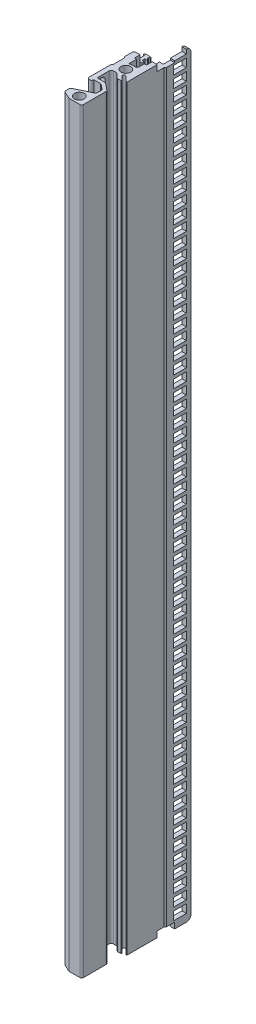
SolidWorks part; units mm, degrees
ref_plane "前视基准面" through (0, 0, 0) normal (0, 0, 1) x (1, 0, 0)
ref_plane "上视基准面" through (0, 0, 0) normal (0, 1, 0) x (1, 0, 0)
ref_plane "右视基准面" through (0, 0, 0) normal (1, 0, 0) x (0, 0, -1)
sketch "草图1" plane through (0, 0, 0) normal (0, 1, 0) x (1, 0, 0)
  line L0 (-4.2, 11.9) -> (-3.9, 11.9)
  line L1 (-4.4, 12.2) -> (-4.4, 12.1)
  line L2 (-4.0328, 12.4) -> (-4.2, 12.4)
  line L3 (-3.85, 12.5) -> (-3.8914, 12.4586)
  line L4 (-2.05, 12.5) -> (-3.85, 12.5)
  line L5 (-2.0086, 12.4586) -> (-2.05, 12.5)
  line L6 (-1.7, 12.4) -> (-1.8672, 12.4)
  line L7 (-1.5, 12.1) -> (-1.5, 12.2)
  line L8 (-1.8, 11.9) -> (-1.7, 11.9)
  line L9 (-2, 11.4828) -> (-2, 11.7)
  line L10 (-1.3586, 10.7586) -> (-1.9414, 11.3414)
  line L11 (-1.3, 10.55) -> (-1.3, 10.6172)
  line L12 (-3.7, 11.7) -> (-3.7, 9.95)
  line L13 (-5, -10.75) -> (-5, -1.6)
  line L14 (-3, -9.35) -> (-3, -5.75)
  line L16 (1.6887, -3.3855) -> (3.2118, -4.9086)
  line L17 (2.5373, -2.537) -> (4.6586, -4.6583)
  line L18 (5, 15) -> (5, 5.1793)
  line L19 (3.6, 15) -> (5, 15)
  line L20 (3.6, 12.5) -> (3.6, 15)
  line L21 (1.95, 12.5) -> (3.6, 12.5)
  line L22 (1.95, 10.55) -> (1.95, 12.5)
  line L23 (2.85, 10.55) -> (1.95, 10.55)
  line L24 (2.85, 9.35) -> (2.85, 10.55)
  line L25 (1.95, 9.35) -> (2.85, 9.35)
  line L26 (1.95, 8.35) -> (1.95, 9.35)
  line L27 (2.85, 8.35) -> (1.95, 8.35)
  line L28 (2.85, 6.05) -> (2.85, 8.35)
  line L29 (1.95, 6.05) -> (2.85, 6.05)
  line L30 (1.95, 3.8856) -> (1.95, 6.05)
  line L31 (-1.45, 6.05) -> (-1.45, 2.9458)
  line L32 (-2.35, 6.05) -> (-1.45, 6.05)
  line L33 (-2.35, 8.35) -> (-2.35, 6.05)
  line L34 (-1.45, 8.35) -> (-2.35, 8.35)
  line L35 (-1.45, 9.35) -> (-1.45, 8.35)
  line L36 (-2.35, 9.35) -> (-1.45, 9.35)
  line L37 (-2.35, 10.55) -> (-2.35, 9.35)
  line L38 (-1.3, 10.55) -> (-2.35, 10.55)
  line L39 (-4.45, 7.7) -> (-4.7, 7.7)
  line L40 (-5, 7.4) -> (-4.7, 7.7)
  line L41 (-5, 4.4) -> (-5, 7.4)
  line L42 (-4.5499, 3.8998) -> (-5, 4.4)
  line L43 (-4.45, 7.7) -> (-4.45, 9.55)
  line L44 (-3.9, 9.75) -> (-4.25, 9.75)
  line L45 (-4.5499, 3.8998) -> (-4.5501, -1.1002)
  line L46 (-5, -1.6) -> (-4.5501, -1.1002)
  line L47 (4.9414, -1.9395) -> (4.6464, -1.6446) construction
  line L48 (5, -2.081) -> (5, -4.5169)
  line L49 (0, 0) -> (0, -5) construction
  line L50 (4.5, -1.291) -> (4.5, 4.3894) construction
  line L53 (-2.5, -5.25) -> (3.0703, -5.25)
  line L54 (2.5373, -2.537) -> (1.6887, -3.3855) construction
  line L55 (5, 5.1793) -> (5, -2.081)
  line L58 (4.9414, 5.0379) -> (4.6464, 4.743) construction
  line L121 (-3, -9.35) -> (4, -9.35)
  line L122 (-4.2, -17.25) -> (2.6, -17.25)
  line L123 (-5, -22.2) -> (-5, -18.05)
  line L124 (-3, -10.75) -> (2.6, -10.75)
  line L125 (4, -9.35) -> (4, -22.2)
  line L126 (3.2, -23) -> (-4.2, -23)
  line L127 (2.6, -10.75) -> (2.6, -17.25)
  circle A0 centre (0, 0) radius 1.6
  arc A1 (-4.4, 12.1) -> (-4.2, 11.9) centre (-4.2, 12.1) ccw
  arc A2 (-4.2, 12.4) -> (-4.4, 12.2) centre (-4.2, 12.2) ccw
  arc A3 (-4.0328, 12.4) -> (-3.8914, 12.4586) centre (-4.0328, 12.6) ccw
  arc A4 (-2.0086, 12.4586) -> (-1.8672, 12.4) centre (-1.8672, 12.6) ccw
  arc A5 (-1.5, 12.2) -> (-1.7, 12.4) centre (-1.7, 12.2) ccw
  arc A6 (-1.7, 11.9) -> (-1.5, 12.1) centre (-1.7, 12.1) ccw
  arc A7 (-1.8, 11.9) -> (-2, 11.7) centre (-1.8, 11.7) ccw
  arc A8 (-2, 11.4828) -> (-1.9414, 11.3414) centre (-1.8, 11.4828) ccw
  arc A9 (-1.3, 10.6172) -> (-1.3586, 10.7586) centre (-1.5, 10.6172) ccw
  arc A11 (3.0703, -5.25) -> (3.2118, -4.9086) centre (3.0703, -5.05) ccw
  arc A12 (-4.25, 9.75) -> (-4.45, 9.55) centre (-4.25, 9.55) ccw
  arc A13 (-3.9, 9.75) -> (-3.7, 9.95) centre (-3.9, 9.95) ccw
  arc A14 (5, -2.081) -> (4.9414, -1.9395) centre (4.8, -2.081) ccw construction
  arc A15 (4.9414, 5.0379) -> (5, 5.1793) centre (4.8, 5.1793) ccw construction
  arc A16 (4.6586, -4.6583) -> (5, -4.5169) centre (4.8, -4.5169) ccw
  arc A17 (2.5373, -2.537) -> (1.6887, -3.3855) centre (2.113, -2.9613) ccw
  arc A18 (0.7125, 2.9142) -> (-1.1719, 2.7616) centre (0, 0) ccw
  arc A19 (-1.45, 2.9458) -> (-1.1719, 2.7616) centre (-1.25, 2.9458) ccw
  arc A20 (0.7125, 2.9142) -> (1.95, 3.8856) centre (0.95, 3.8856) ccw
  arc A21 (-3.7, 11.7) -> (-3.9, 11.9) centre (-3.9, 11.7) ccw
  arc A22 (4.6464, -1.6446) -> (4.5, -1.291) centre (5, -1.291) cw construction
  arc A23 (4.5, 4.3894) -> (4.6464, 4.743) centre (5, 4.3894) cw construction
  arc A29 (-3, -5.75) -> (-2.5, -5.25) centre (-2.5, -5.75) cw
  arc A60 (-5, -22.2) -> (-4.2, -23) centre (-4.2, -22.2) ccw
  circle A61 centre (0, -20) radius 1.6
  arc A62 (-4.2, -17.25) -> (-5, -18.05) centre (-4.2, -18.05) ccw
  arc A63 (-5, -10.75) -> (-3, -10.75) centre (-4, -10.75) ccw
  arc A64 (3.2, -23) -> (4, -22.2) centre (3.2, -22.2) ccw
  dimension "D1" = 3.2
  dimension "D3" = 5.2
  dimension "D4" = 45
  dimension "D5" = 1.2
  dimension "D7" = 0.6
  dimension "D8" = 0.2
  dimension "D10" = 4.1
  dimension "D11" = 1.4
  dimension "D12" = 0.5
  dimension "D13" = 0.5
  dimension "D14" = 1
  dimension "D33" = 3.2
  dimension "D34" = 20
  dimension "D37" = 0.8
  dimension "D38" = 0.8
  dimension "D39" = 0.8
  dimension "D6" = 3
  dimension "D9" = 2.1225
  dimension "D28" = 38
  dimension "D29" = 13.65
  dimension "D30" = 1
  dimension "D31" = 9
  dimension "D32" = 5.75
  dimension "D36" = 6.5
extrude "凸台-拉伸1" add sketch "草图1" along normal mid plane 325.12
sketch "草图6" plane through (0, 162.56, 0) normal (0, 1, 0) x (1, 0, 0)
  line L0 (3.6, 12.5) -> (3.6, 22.5)
  line L1 (3.6, 22.5) -> (5.5, 22.5)
  line L2 (5.5, 22.5) -> (5.5, 12)
  line L3 (5.5, 12) -> (5, 11.5)
  line L4 (3.6, 12.5) -> (5, 11.5)
  line L5 (5, -4.5169) -> (5, 15) construction
  line L6 (-5, 7.4) -> (-5, 4.4) construction
  dimension "D4" = 11
  dimension "D1" = 10.5
  dimension "D2" = 10
  dimension "D3" = 45
extrude "凸台-拉伸2" add sketch "草图6" against normal up to surface (325.12 mm away)
sketch "草图2" plane through (0, 162.56, 0) normal (0, 1, 0) x (1, 0, 0)
  circle A0 centre (0, 0) radius 2.1
  circle A1 centre (0, -20) radius 2.1
  dimension "D1" = 4.2
  dimension "D2" = 4.2
extrude "切除-拉伸1" cut sketch "草图2" against normal blind 10
sketch "草图3" plane through (0, -162.56, 0) normal (0, -1, 0) x (1, 0, 0)
  circle A0 centre (0, 0) radius 2.1
  circle A1 centre (0, 20) radius 2.1
  dimension "D1" = 4.2
  dimension "D2" = 4.2
extrude "切除-拉伸2" cut sketch "草图3" against normal blind 10
sketch "草图4" plane through (-5, 0, 0) normal (-1, 0, 0) x (0, 0, 1)
  line L0 (1.6, -162.56) -> (10.75, -162.56) construction
  line L2 (11.75, -162.56) -> (11.75, 162.56) construction
  circle A0 centre (7.5, -160.02) radius 1.65
  circle A1 centre (7.5, -154.94) radius 1.65
  circle A2 centre (7.5, -149.86) radius 1.65
  circle A3 centre (7.5, -144.78) radius 1.65
  circle A4 centre (7.5, -139.7) radius 1.65
  circle A5 centre (7.5, -134.62) radius 1.65
  circle A6 centre (7.5, -129.54) radius 1.65
  circle A7 centre (7.5, -124.46) radius 1.65
  circle A8 centre (7.5, -119.38) radius 1.65
  circle A9 centre (7.5, -114.3) radius 1.65
  circle A10 centre (7.5, -109.22) radius 1.65
  circle A11 centre (7.5, -104.14) radius 1.65
  circle A12 centre (7.5, -99.06) radius 1.65
  circle A13 centre (7.5, -93.98) radius 1.65
  circle A14 centre (7.5, -88.9) radius 1.65
  circle A15 centre (7.5, -83.82) radius 1.65
  circle A16 centre (7.5, -78.74) radius 1.65
  circle A17 centre (7.5, -73.66) radius 1.65
  circle A18 centre (7.5, -68.58) radius 1.65
  circle A19 centre (7.5, -63.5) radius 1.65
  circle A20 centre (7.5, -58.42) radius 1.65
  circle A21 centre (7.5, -53.34) radius 1.65
  circle A22 centre (7.5, -48.26) radius 1.65
  circle A23 centre (7.5, -43.18) radius 1.65
  circle A24 centre (7.5, -38.1) radius 1.65
  circle A25 centre (7.5, -33.02) radius 1.65
  circle A26 centre (7.5, -27.94) radius 1.65
  circle A27 centre (7.5, -22.86) radius 1.65
  circle A28 centre (7.5, -17.78) radius 1.65
  circle A29 centre (7.5, -12.7) radius 1.65
  circle A30 centre (7.5, -7.62) radius 1.65
  circle A31 centre (7.5, -2.54) radius 1.65
  circle A32 centre (7.5, 2.54) radius 1.65
  circle A33 centre (7.5, 7.62) radius 1.65
  circle A34 centre (7.5, 12.7) radius 1.65
  circle A35 centre (7.5, 17.78) radius 1.65
  circle A36 centre (7.5, 22.86) radius 1.65
  circle A37 centre (7.5, 27.94) radius 1.65
  circle A38 centre (7.5, 33.02) radius 1.65
  circle A39 centre (7.5, 38.1) radius 1.65
  circle A40 centre (7.5, 43.18) radius 1.65
  circle A41 centre (7.5, 48.26) radius 1.65
  circle A42 centre (7.5, 53.34) radius 1.65
  circle A43 centre (7.5, 58.42) radius 1.65
  circle A44 centre (7.5, 63.5) radius 1.65
  circle A45 centre (7.5, 68.58) radius 1.65
  circle A46 centre (7.5, 73.66) radius 1.65
  circle A47 centre (7.5, 78.74) radius 1.65
  circle A48 centre (7.5, 83.82) radius 1.65
  circle A49 centre (7.5, 88.9) radius 1.65
  circle A50 centre (7.5, 93.98) radius 1.65
  circle A51 centre (7.5, 99.06) radius 1.65
  circle A52 centre (7.5, 104.14) radius 1.65
  circle A53 centre (7.5, 109.22) radius 1.65
  circle A54 centre (7.5, 114.3) radius 1.65
  circle A55 centre (7.5, 119.38) radius 1.65
  circle A56 centre (7.5, 124.46) radius 1.65
  circle A57 centre (7.5, 129.54) radius 1.65
  circle A58 centre (7.5, 134.62) radius 1.65
  circle A59 centre (7.5, 139.7) radius 1.65
  circle A60 centre (7.5, 144.78) radius 1.65
  circle A61 centre (7.5, 149.86) radius 1.65
  circle A62 centre (7.5, 154.94) radius 1.65
  circle A63 centre (7.5, 160.02) radius 1.65
  circle A64 centre (7.5, 165.1) radius 1.65
  circle A65 centre (7.5, 170.18) radius 1.65
  circle A66 centre (7.5, 175.26) radius 1.65
  circle A67 centre (7.5, 180.34) radius 1.65
  circle A68 centre (7.5, 185.42) radius 1.65
  circle A69 centre (7.5, 190.5) radius 1.65
  circle A70 centre (7.5, 195.58) radius 1.65
  circle A71 centre (7.5, 200.66) radius 1.65
  circle A72 centre (7.5, 205.74) radius 1.65
  circle A73 centre (7.5, 210.82) radius 1.65
  circle A74 centre (7.5, 215.9) radius 1.65
  circle A75 centre (7.5, 220.98) radius 1.65
  circle A76 centre (7.5, 226.06) radius 1.65
  circle A77 centre (7.5, 231.14) radius 1.65
  circle A78 centre (7.5, 236.22) radius 1.65
  circle A79 centre (7.5, 241.3) radius 1.65
  circle A80 centre (7.5, 246.38) radius 1.65
  circle A81 centre (7.5, 251.46) radius 1.65
  circle A82 centre (7.5, 256.54) radius 1.65
  circle A83 centre (7.5, 261.62) radius 1.65
  circle A84 centre (7.5, 266.7) radius 1.65
  dimension "D1" = 2.54
  dimension "D2" = 4.25
  dimension "D3" = 3.3
  dimension "D5" = 5.08
  dimension "D4" = 85
extrude "切除-拉伸3" cut sketch "草图4" against normal blind 12
sketch "草图5" plane through (5.5, 0, 0) normal (1, 0, 0) x (0, 0, -1)
  line L0 (-19.1753, 0) -> (41.1348, 0) construction
  line L1 (15.5, 162.56) -> (8.5, 162.56)
  line L2 (15.5, 162.56) -> (15.5, 160.02)
  line L3 (15.5, 160.02) -> (8.5, 160.02)
  line L4 (8.5, 162.56) -> (8.5, 160.02)
  line L6 (8.5, -162.56) -> (8.5, -160.02)
  line L7 (15.5, -160.02) -> (8.5, -160.02)
  line L8 (15.5, -162.56) -> (15.5, -160.02)
  line L9 (15.5, -162.56) -> (8.5, -162.56)
  line L10 (12, 162.56) -> (22.5, 162.56) construction
  line L11 (22.5, -162.56) -> (22.5, 162.56) construction
  dimension "D1" = 7
  dimension "D2" = 2.54
  dimension "D3" = 7
extrude "切除-拉伸4" cut sketch "草图5" against normal through all
sketch "草图7" plane through (5.5, 0, 0) normal (1, 0, 0) x (0, 0, -1)
  line L0 (22.5, -162.56) -> (22.5, 162.56) construction
  line L1 (15, -159.28) -> (20.5, -159.28)
  line L2 (15, -159.28) -> (15, -155.68)
  line L3 (15, -155.68) -> (20.5, -155.68)
  line L4 (20.5, -159.28) -> (20.5, -155.68)
  line L5 (22.5, -162.56) -> (15.5, -162.56) construction
  line L6 (15, -154.2) -> (20.5, -154.2)
  line L7 (15, -154.2) -> (15, -150.6)
  line L8 (15, -150.6) -> (20.5, -150.6)
  line L9 (20.5, -154.2) -> (20.5, -150.6)
  line L10 (15, -149.12) -> (20.5, -149.12)
  line L11 (15, -149.12) -> (15, -145.52)
  line L12 (15, -145.52) -> (20.5, -145.52)
  line L13 (20.5, -149.12) -> (20.5, -145.52)
  line L14 (15, -144.04) -> (20.5, -144.04)
  line L15 (15, -144.04) -> (15, -140.44)
  line L16 (15, -140.44) -> (20.5, -140.44)
  line L17 (20.5, -144.04) -> (20.5, -140.44)
  line L18 (15, -138.96) -> (20.5, -138.96)
  line L19 (15, -138.96) -> (15, -135.36)
  line L20 (15, -135.36) -> (20.5, -135.36)
  line L21 (20.5, -138.96) -> (20.5, -135.36)
  line L22 (15, -133.88) -> (20.5, -133.88)
  line L23 (15, -133.88) -> (15, -130.28)
  line L24 (15, -130.28) -> (20.5, -130.28)
  line L25 (20.5, -133.88) -> (20.5, -130.28)
  line L26 (15, -128.8) -> (20.5, -128.8)
  line L27 (15, -128.8) -> (15, -125.2)
  line L28 (15, -125.2) -> (20.5, -125.2)
  line L29 (20.5, -128.8) -> (20.5, -125.2)
  line L30 (15, -123.72) -> (20.5, -123.72)
  line L31 (15, -123.72) -> (15, -120.12)
  line L32 (15, -120.12) -> (20.5, -120.12)
  line L33 (20.5, -123.72) -> (20.5, -120.12)
  line L34 (15, -118.64) -> (20.5, -118.64)
  line L35 (15, -118.64) -> (15, -115.04)
  line L36 (15, -115.04) -> (20.5, -115.04)
  line L37 (20.5, -118.64) -> (20.5, -115.04)
  line L38 (15, -113.56) -> (20.5, -113.56)
  line L39 (15, -113.56) -> (15, -109.96)
  line L40 (15, -109.96) -> (20.5, -109.96)
  line L41 (20.5, -113.56) -> (20.5, -109.96)
  line L42 (15, -108.48) -> (20.5, -108.48)
  line L43 (15, -108.48) -> (15, -104.88)
  line L44 (15, -104.88) -> (20.5, -104.88)
  line L45 (20.5, -108.48) -> (20.5, -104.88)
  line L46 (15, -103.4) -> (20.5, -103.4)
  line L47 (15, -103.4) -> (15, -99.8)
  line L48 (15, -99.8) -> (20.5, -99.8)
  line L49 (20.5, -103.4) -> (20.5, -99.8)
  line L50 (15, -98.32) -> (20.5, -98.32)
  line L51 (15, -98.32) -> (15, -94.72)
  line L52 (15, -94.72) -> (20.5, -94.72)
  line L53 (20.5, -98.32) -> (20.5, -94.72)
  line L54 (15, -93.24) -> (20.5, -93.24)
  line L55 (15, -93.24) -> (15, -89.64)
  line L56 (15, -89.64) -> (20.5, -89.64)
  line L57 (20.5, -93.24) -> (20.5, -89.64)
  line L58 (15, -88.16) -> (20.5, -88.16)
  line L59 (15, -88.16) -> (15, -84.56)
  line L60 (15, -84.56) -> (20.5, -84.56)
  line L61 (20.5, -88.16) -> (20.5, -84.56)
  line L62 (15, -83.08) -> (20.5, -83.08)
  line L63 (15, -83.08) -> (15, -79.48)
  line L64 (15, -79.48) -> (20.5, -79.48)
  line L65 (20.5, -83.08) -> (20.5, -79.48)
  line L66 (15, -78) -> (20.5, -78)
  line L67 (15, -78) -> (15, -74.4)
  line L68 (15, -74.4) -> (20.5, -74.4)
  line L69 (20.5, -78) -> (20.5, -74.4)
  line L70 (15, -72.92) -> (20.5, -72.92)
  line L71 (15, -72.92) -> (15, -69.32)
  line L72 (15, -69.32) -> (20.5, -69.32)
  line L73 (20.5, -72.92) -> (20.5, -69.32)
  line L74 (15, -67.84) -> (20.5, -67.84)
  line L75 (15, -67.84) -> (15, -64.24)
  line L76 (15, -64.24) -> (20.5, -64.24)
  line L77 (20.5, -67.84) -> (20.5, -64.24)
  line L78 (15, -62.76) -> (20.5, -62.76)
  line L79 (15, -62.76) -> (15, -59.16)
  line L80 (15, -59.16) -> (20.5, -59.16)
  line L81 (20.5, -62.76) -> (20.5, -59.16)
  line L82 (15, -57.68) -> (20.5, -57.68)
  line L83 (15, -57.68) -> (15, -54.08)
  line L84 (15, -54.08) -> (20.5, -54.08)
  line L85 (20.5, -57.68) -> (20.5, -54.08)
  line L86 (15, -52.6) -> (20.5, -52.6)
  line L87 (15, -52.6) -> (15, -49)
  line L88 (15, -49) -> (20.5, -49)
  line L89 (20.5, -52.6) -> (20.5, -49)
  line L90 (15, -47.52) -> (20.5, -47.52)
  line L91 (15, -47.52) -> (15, -43.92)
  line L92 (15, -43.92) -> (20.5, -43.92)
  line L93 (20.5, -47.52) -> (20.5, -43.92)
  line L94 (15, -42.44) -> (20.5, -42.44)
  line L95 (15, -42.44) -> (15, -38.84)
  line L96 (15, -38.84) -> (20.5, -38.84)
  line L97 (20.5, -42.44) -> (20.5, -38.84)
  line L98 (15, -37.36) -> (20.5, -37.36)
  line L99 (15, -37.36) -> (15, -33.76)
  line L100 (15, -33.76) -> (20.5, -33.76)
  line L101 (20.5, -37.36) -> (20.5, -33.76)
  line L102 (15, -32.28) -> (20.5, -32.28)
  line L103 (15, -32.28) -> (15, -28.68)
  line L104 (15, -28.68) -> (20.5, -28.68)
  line L105 (20.5, -32.28) -> (20.5, -28.68)
  line L106 (15, -27.2) -> (20.5, -27.2)
  line L107 (15, -27.2) -> (15, -23.6)
  line L108 (15, -23.6) -> (20.5, -23.6)
  line L109 (20.5, -27.2) -> (20.5, -23.6)
  line L110 (15, -22.12) -> (20.5, -22.12)
  line L111 (15, -22.12) -> (15, -18.52)
  line L112 (15, -18.52) -> (20.5, -18.52)
  line L113 (20.5, -22.12) -> (20.5, -18.52)
  line L114 (15, -17.04) -> (20.5, -17.04)
  line L115 (15, -17.04) -> (15, -13.44)
  line L116 (15, -13.44) -> (20.5, -13.44)
  line L117 (20.5, -17.04) -> (20.5, -13.44)
  line L118 (15, -11.96) -> (20.5, -11.96)
  line L119 (15, -11.96) -> (15, -8.36)
  line L120 (15, -8.36) -> (20.5, -8.36)
  line L121 (20.5, -11.96) -> (20.5, -8.36)
  line L122 (15, -6.88) -> (20.5, -6.88)
  line L123 (15, -6.88) -> (15, -3.28)
  line L124 (15, -3.28) -> (20.5, -3.28)
  line L125 (20.5, -6.88) -> (20.5, -3.28)
  line L126 (15, -1.8) -> (20.5, -1.8)
  line L127 (15, -1.8) -> (15, 1.8)
  line L128 (15, 1.8) -> (20.5, 1.8)
  line L129 (20.5, -1.8) -> (20.5, 1.8)
  line L130 (15, 3.28) -> (20.5, 3.28)
  line L131 (15, 3.28) -> (15, 6.88)
  line L132 (15, 6.88) -> (20.5, 6.88)
  line L133 (20.5, 3.28) -> (20.5, 6.88)
  line L134 (15, 8.36) -> (20.5, 8.36)
  line L135 (15, 8.36) -> (15, 11.96)
  line L136 (15, 11.96) -> (20.5, 11.96)
  line L137 (20.5, 8.36) -> (20.5, 11.96)
  line L138 (15, 13.44) -> (20.5, 13.44)
  line L139 (15, 13.44) -> (15, 17.04)
  line L140 (15, 17.04) -> (20.5, 17.04)
  line L141 (20.5, 13.44) -> (20.5, 17.04)
  line L142 (15, 18.52) -> (20.5, 18.52)
  line L143 (15, 18.52) -> (15, 22.12)
  line L144 (15, 22.12) -> (20.5, 22.12)
  line L145 (20.5, 18.52) -> (20.5, 22.12)
  line L146 (15, 23.6) -> (20.5, 23.6)
  line L147 (15, 23.6) -> (15, 27.2)
  line L148 (15, 27.2) -> (20.5, 27.2)
  line L149 (20.5, 23.6) -> (20.5, 27.2)
  line L150 (15, 28.68) -> (20.5, 28.68)
  line L151 (15, 28.68) -> (15, 32.28)
  line L152 (15, 32.28) -> (20.5, 32.28)
  line L153 (20.5, 28.68) -> (20.5, 32.28)
  line L154 (15, 33.76) -> (20.5, 33.76)
  line L155 (15, 33.76) -> (15, 37.36)
  line L156 (15, 37.36) -> (20.5, 37.36)
  line L157 (20.5, 33.76) -> (20.5, 37.36)
  line L158 (15, 38.84) -> (20.5, 38.84)
  line L159 (15, 38.84) -> (15, 42.44)
  line L160 (15, 42.44) -> (20.5, 42.44)
  line L161 (20.5, 38.84) -> (20.5, 42.44)
  line L162 (15, 43.92) -> (20.5, 43.92)
  line L163 (15, 43.92) -> (15, 47.52)
  line L164 (15, 47.52) -> (20.5, 47.52)
  line L165 (20.5, 43.92) -> (20.5, 47.52)
  line L166 (15, 49) -> (20.5, 49)
  line L167 (15, 49) -> (15, 52.6)
  line L168 (15, 52.6) -> (20.5, 52.6)
  line L169 (20.5, 49) -> (20.5, 52.6)
  line L170 (15, 54.08) -> (20.5, 54.08)
  line L171 (15, 54.08) -> (15, 57.68)
  line L172 (15, 57.68) -> (20.5, 57.68)
  line L173 (20.5, 54.08) -> (20.5, 57.68)
  line L174 (15, 59.16) -> (20.5, 59.16)
  line L175 (15, 59.16) -> (15, 62.76)
  line L176 (15, 62.76) -> (20.5, 62.76)
  line L177 (20.5, 59.16) -> (20.5, 62.76)
  line L178 (15, 64.24) -> (20.5, 64.24)
  line L179 (15, 64.24) -> (15, 67.84)
  line L180 (15, 67.84) -> (20.5, 67.84)
  line L181 (20.5, 64.24) -> (20.5, 67.84)
  line L182 (15, 69.32) -> (20.5, 69.32)
  line L183 (15, 69.32) -> (15, 72.92)
  line L184 (15, 72.92) -> (20.5, 72.92)
  line L185 (20.5, 69.32) -> (20.5, 72.92)
  line L186 (15, 74.4) -> (20.5, 74.4)
  line L187 (15, 74.4) -> (15, 78)
  line L188 (15, 78) -> (20.5, 78)
  line L189 (20.5, 74.4) -> (20.5, 78)
  line L190 (15, 79.48) -> (20.5, 79.48)
  line L191 (15, 79.48) -> (15, 83.08)
  line L192 (15, 83.08) -> (20.5, 83.08)
  line L193 (20.5, 79.48) -> (20.5, 83.08)
  line L194 (15, 84.56) -> (20.5, 84.56)
  line L195 (15, 84.56) -> (15, 88.16)
  line L196 (15, 88.16) -> (20.5, 88.16)
  line L197 (20.5, 84.56) -> (20.5, 88.16)
  line L198 (15, 89.64) -> (20.5, 89.64)
  line L199 (15, 89.64) -> (15, 93.24)
  line L200 (15, 93.24) -> (20.5, 93.24)
  line L201 (20.5, 89.64) -> (20.5, 93.24)
  line L202 (15, 94.72) -> (20.5, 94.72)
  line L203 (15, 94.72) -> (15, 98.32)
  line L204 (15, 98.32) -> (20.5, 98.32)
  line L205 (20.5, 94.72) -> (20.5, 98.32)
  line L206 (15, 99.8) -> (20.5, 99.8)
  line L207 (15, 99.8) -> (15, 103.4)
  line L208 (15, 103.4) -> (20.5, 103.4)
  line L209 (20.5, 99.8) -> (20.5, 103.4)
  line L210 (15, 104.88) -> (20.5, 104.88)
  line L211 (15, 104.88) -> (15, 108.48)
  line L212 (15, 108.48) -> (20.5, 108.48)
  line L213 (20.5, 104.88) -> (20.5, 108.48)
  line L214 (15, 109.96) -> (20.5, 109.96)
  line L215 (15, 109.96) -> (15, 113.56)
  line L216 (15, 113.56) -> (20.5, 113.56)
  line L217 (20.5, 109.96) -> (20.5, 113.56)
  line L218 (15, 115.04) -> (20.5, 115.04)
  line L219 (15, 115.04) -> (15, 118.64)
  line L220 (15, 118.64) -> (20.5, 118.64)
  line L221 (20.5, 115.04) -> (20.5, 118.64)
  line L222 (15, 120.12) -> (20.5, 120.12)
  line L223 (15, 120.12) -> (15, 123.72)
  line L224 (15, 123.72) -> (20.5, 123.72)
  line L225 (20.5, 120.12) -> (20.5, 123.72)
  line L226 (15, 125.2) -> (20.5, 125.2)
  line L227 (15, 125.2) -> (15, 128.8)
  line L228 (15, 128.8) -> (20.5, 128.8)
  line L229 (20.5, 125.2) -> (20.5, 128.8)
  line L230 (15, 130.28) -> (20.5, 130.28)
  line L231 (15, 130.28) -> (15, 133.88)
  line L232 (15, 133.88) -> (20.5, 133.88)
  line L233 (20.5, 130.28) -> (20.5, 133.88)
  line L234 (15, 135.36) -> (20.5, 135.36)
  line L235 (15, 135.36) -> (15, 138.96)
  line L236 (15, 138.96) -> (20.5, 138.96)
  line L237 (20.5, 135.36) -> (20.5, 138.96)
  line L238 (15, 140.44) -> (20.5, 140.44)
  line L239 (15, 140.44) -> (15, 144.04)
  line L240 (15, 144.04) -> (20.5, 144.04)
  line L241 (20.5, 140.44) -> (20.5, 144.04)
  line L242 (15, 145.52) -> (20.5, 145.52)
  line L243 (15, 145.52) -> (15, 149.12)
  line L244 (15, 149.12) -> (20.5, 149.12)
  line L245 (20.5, 145.52) -> (20.5, 149.12)
  line L246 (15, 150.6) -> (20.5, 150.6)
  line L247 (15, 150.6) -> (15, 154.2)
  line L248 (15, 154.2) -> (20.5, 154.2)
  line L249 (20.5, 150.6) -> (20.5, 154.2)
  line L250 (15, 155.68) -> (20.5, 155.68)
  line L251 (15, 155.68) -> (15, 159.28)
  line L252 (15, 159.28) -> (20.5, 159.28)
  line L253 (20.5, 155.68) -> (20.5, 159.28)
  line L254 (15, 160.76) -> (20.5, 160.76)
  line L255 (15, 160.76) -> (15, 164.36)
  line L256 (15, 164.36) -> (20.5, 164.36)
  line L257 (20.5, 160.76) -> (20.5, 164.36)
  line L258 (15, 165.84) -> (20.5, 165.84)
  line L259 (15, 165.84) -> (15, 169.44)
  line L260 (15, 169.44) -> (20.5, 169.44)
  line L261 (20.5, 165.84) -> (20.5, 169.44)
  line L262 (15, 170.92) -> (20.5, 170.92)
  line L263 (15, 170.92) -> (15, 174.52)
  line L264 (15, 174.52) -> (20.5, 174.52)
  line L265 (20.5, 170.92) -> (20.5, 174.52)
  line L266 (15, 176) -> (20.5, 176)
  line L267 (15, 176) -> (15, 179.6)
  line L268 (15, 179.6) -> (20.5, 179.6)
  line L269 (20.5, 176) -> (20.5, 179.6)
  line L270 (15, 181.08) -> (20.5, 181.08)
  line L271 (15, 181.08) -> (15, 184.68)
  line L272 (15, 184.68) -> (20.5, 184.68)
  line L273 (20.5, 181.08) -> (20.5, 184.68)
  line L274 (15, 186.16) -> (20.5, 186.16)
  line L275 (15, 186.16) -> (15, 189.76)
  line L276 (15, 189.76) -> (20.5, 189.76)
  line L277 (20.5, 186.16) -> (20.5, 189.76)
  line L278 (15, 191.24) -> (20.5, 191.24)
  line L279 (15, 191.24) -> (15, 194.84)
  line L280 (15, 194.84) -> (20.5, 194.84)
  line L281 (20.5, 191.24) -> (20.5, 194.84)
  line L282 (15, 196.32) -> (20.5, 196.32)
  line L283 (15, 196.32) -> (15, 199.92)
  line L284 (15, 199.92) -> (20.5, 199.92)
  line L285 (20.5, 196.32) -> (20.5, 199.92)
  line L286 (15, 201.4) -> (20.5, 201.4)
  line L287 (15, 201.4) -> (15, 205)
  line L288 (15, 205) -> (20.5, 205)
  line L289 (20.5, 201.4) -> (20.5, 205)
  line L290 (15, 206.48) -> (20.5, 206.48)
  line L291 (15, 206.48) -> (15, 210.08)
  line L292 (15, 210.08) -> (20.5, 210.08)
  line L293 (20.5, 206.48) -> (20.5, 210.08)
  line L294 (15, 211.56) -> (20.5, 211.56)
  line L295 (15, 211.56) -> (15, 215.16)
  line L296 (15, 215.16) -> (20.5, 215.16)
  line L297 (20.5, 211.56) -> (20.5, 215.16)
  line L298 (15, 216.64) -> (20.5, 216.64)
  line L299 (15, 216.64) -> (15, 220.24)
  line L300 (15, 220.24) -> (20.5, 220.24)
  line L301 (20.5, 216.64) -> (20.5, 220.24)
  line L302 (15, 221.72) -> (20.5, 221.72)
  line L303 (15, 221.72) -> (15, 225.32)
  line L304 (15, 225.32) -> (20.5, 225.32)
  line L305 (20.5, 221.72) -> (20.5, 225.32)
  line L306 (15, 226.8) -> (20.5, 226.8)
  line L307 (15, 226.8) -> (15, 230.4)
  line L308 (15, 230.4) -> (20.5, 230.4)
  line L309 (20.5, 226.8) -> (20.5, 230.4)
  line L310 (15, 231.88) -> (20.5, 231.88)
  line L311 (15, 231.88) -> (15, 235.48)
  line L312 (15, 235.48) -> (20.5, 235.48)
  line L313 (20.5, 231.88) -> (20.5, 235.48)
  line L314 (15, 236.96) -> (20.5, 236.96)
  line L315 (15, 236.96) -> (15, 240.56)
  line L316 (15, 240.56) -> (20.5, 240.56)
  line L317 (20.5, 236.96) -> (20.5, 240.56)
  line L318 (15, 242.04) -> (20.5, 242.04)
  line L319 (15, 242.04) -> (15, 245.64)
  line L320 (15, 245.64) -> (20.5, 245.64)
  line L321 (20.5, 242.04) -> (20.5, 245.64)
  line L322 (15, 247.12) -> (20.5, 247.12)
  line L323 (15, 247.12) -> (15, 250.72)
  line L324 (15, 250.72) -> (20.5, 250.72)
  line L325 (20.5, 247.12) -> (20.5, 250.72)
  line L326 (15, 252.2) -> (20.5, 252.2)
  line L327 (15, 252.2) -> (15, 255.8)
  line L328 (15, 255.8) -> (20.5, 255.8)
  line L329 (20.5, 252.2) -> (20.5, 255.8)
  line L330 (15, 257.28) -> (20.5, 257.28)
  line L331 (15, 257.28) -> (15, 260.88)
  line L332 (15, 260.88) -> (20.5, 260.88)
  line L333 (20.5, 257.28) -> (20.5, 260.88)
  line L334 (15, 262.36) -> (20.5, 262.36)
  line L335 (15, 262.36) -> (15, 265.96)
  line L336 (15, 265.96) -> (20.5, 265.96)
  line L337 (20.5, 262.36) -> (20.5, 265.96)
  dimension "D1" = 3.6
  dimension "D2" = 5.5
  dimension "D3" = 2
  dimension "D4" = 3.28
  dimension "D5" = 84
extrude "切除-拉伸5" cut sketch "草图7" against normal blind 10
fillet "圆角1" radius 2 2 edges at (4.55, -162.56, -22.5) (4.55, 162.56, -22.5)
sketch "草图8" plane through (0, -162.56, 0) normal (0, -1, 0) x (1, 0, 0)
  line L0 (-4.45, -8.5) -> (-5, -8.5)
  line L1 (-4.45, -8.5) -> (-4.45, -7.7)
  line L3 (-4.45, -7.7) -> (-4.7, -7.7)
  line L4 (-4.7, -7.7) -> (-5, -7.4)
  line L5 (-5, -7.4) -> (-5, -8.5)
extrude "凸台-拉伸3" add sketch "草图8" against normal through all
chamfer "倒角1" distance 0.55 angle 45 1 edges at (-5, 0, -8.5)
sketch "草图9" plane through (0, 0, -8.5) normal (0, 0, -1) x (-1, 0, 0)
  line L0 (4.45, 160.02) -> (1.45, 160.02) construction
  line L1 (1.45, 162.56) -> (2.35, 162.56)
  line L2 (1.45, 162.56) -> (1.45, 160.02)
  line L3 (1.45, 160.02) -> (2.35, 160.02)
  line L4 (2.35, 162.56) -> (2.35, 160.02)
  line L5 (2.35, 162.56) -> (2.35, -162.56) construction
  line L6 (-1.95, 160.02) -> (-5, 160.02) construction
  line L7 (-1.95, 162.56) -> (-2.85, 162.56)
  line L8 (-1.95, 162.56) -> (-1.95, 160.02)
  line L9 (-1.95, 160.02) -> (-2.85, 160.02)
  line L10 (-2.85, 162.56) -> (-2.85, 160.02)
  line L11 (-2.85, 162.56) -> (-2.85, -162.56) construction
  line L12 (5, 0) -> (-5.5, 0) construction
  line L13 (5, 162.56) -> (5, -162.56) construction
  line L14 (-5.5, -160.56) -> (-5.5, 160.56) construction
  line L15 (-2.85, -162.56) -> (-2.85, -160.02)
  line L16 (-1.95, -160.02) -> (-2.85, -160.02)
  line L17 (-1.95, -162.56) -> (-1.95, -160.02)
  line L18 (-1.95, -162.56) -> (-2.85, -162.56)
  line L19 (2.35, -162.56) -> (2.35, -160.02)
  line L20 (1.45, -160.02) -> (2.35, -160.02)
  line L21 (1.45, -162.56) -> (1.45, -160.02)
  line L22 (1.45, -162.56) -> (2.35, -162.56)
extrude "切除-拉伸6" cut sketch "草图9" against normal up to surface (0.15 mm away)
sketch "草图10" plane through (0, 162.56, 0) normal (0, 1, 0) x (1, 0, 0)
  line L0 (-5, -19.75) -> (-1, -23)
  line L1 (-5, -18.05) -> (-5, -22.2) construction
  line L2 (-4.2, -23) -> (3.2, -23) construction
  line L3 (-1, -23) -> (-5, -23)
  line L4 (-5, -23) -> (-5, -19.75)
  line L5 (2.6, -17.25) -> (-4.2, -17.25) construction
  dimension "D1" = 2.5
  dimension "D2" = 4
extrude "切除-拉伸7" [suppressed] cut sketch "草图10" against normal through all
fillet "圆角2" [suppressed] radius 0.8
sketch "草图11" plane through (-5, 0, 0) normal (-1, 0, 0) x (0, 0, 1)
  line L0 (-4.4, 162.56) -> (-4.4, -162.56) construction
  line L1 (-4.4, 119.63) -> (-7.95, 119.63)
  line L2 (-4.4, 119.63) -> (-4.4, 119.13)
  line L3 (-4.4, 119.13) -> (-7.95, 119.13)
  line L4 (-7.95, 119.63) -> (-7.95, 119.13)
  line L5 (-4.4, 119.63) -> (-7.95, 119.13) construction
  line L6 (-4.4, 119.13) -> (-7.95, 119.63) construction
  line L7 (-7.95, 162.56) -> (-7.95, -162.56) construction
  line L8 (-9.95, 160.02) -> (-11.7, 160.02) construction
  line L9 (-4.4, 78.99) -> (-4.4, 78.49)
  line L10 (-4.4, 78.99) -> (-7.95, 78.99)
  line L11 (-4.4, 78.49) -> (-7.95, 78.99) construction
  line L12 (-4.4, 78.99) -> (-7.95, 78.49) construction
  line L13 (-4.4, 78.49) -> (-7.95, 78.49)
  line L14 (-7.95, 78.99) -> (-7.95, 78.49)
  line L15 (-4.4, 38.35) -> (-4.4, 37.85)
  line L16 (-4.4, 38.35) -> (-7.95, 38.35)
  line L17 (-4.4, 37.85) -> (-7.95, 38.35) construction
  line L18 (-4.4, 38.35) -> (-7.95, 37.85) construction
  line L19 (-4.4, 37.85) -> (-7.95, 37.85)
  line L20 (-7.95, 38.35) -> (-7.95, 37.85)
  line L21 (-4.4, -2.29) -> (-4.4, -2.79)
  line L22 (-4.4, -2.29) -> (-7.95, -2.29)
  line L23 (-4.4, -2.79) -> (-7.95, -2.29) construction
  line L24 (-4.4, -2.29) -> (-7.95, -2.79) construction
  line L25 (-4.4, -2.79) -> (-7.95, -2.79)
  line L26 (-7.95, -2.29) -> (-7.95, -2.79)
  line L27 (-4.4, -42.93) -> (-4.4, -43.43)
  line L28 (-4.4, -42.93) -> (-7.95, -42.93)
  line L29 (-4.4, -43.43) -> (-7.95, -42.93) construction
  line L30 (-4.4, -42.93) -> (-7.95, -43.43) construction
  line L31 (-4.4, -43.43) -> (-7.95, -43.43)
  line L32 (-7.95, -42.93) -> (-7.95, -43.43)
  line L33 (-4.4, -83.57) -> (-4.4, -84.07)
  line L34 (-4.4, -83.57) -> (-7.95, -83.57)
  line L35 (-4.4, -84.07) -> (-7.95, -83.57) construction
  line L36 (-4.4, -83.57) -> (-7.95, -84.07) construction
  line L37 (-4.4, -84.07) -> (-7.95, -84.07)
  line L38 (-7.95, -83.57) -> (-7.95, -84.07)
  line L39 (-4.4, -124.21) -> (-4.4, -124.71)
  line L40 (-4.4, -124.21) -> (-7.95, -124.21)
  line L41 (-4.4, -124.71) -> (-7.95, -124.21) construction
  line L42 (-4.4, -124.21) -> (-7.95, -124.71) construction
  line L43 (-4.4, -124.71) -> (-7.95, -124.71)
  line L44 (-7.95, -124.21) -> (-7.95, -124.71)
  line L45 (-4.4, -164.85) -> (-4.4, -165.35)
  line L46 (-4.4, -164.85) -> (-7.95, -164.85)
  line L47 (-4.4, -165.35) -> (-7.95, -164.85) construction
  line L48 (-4.4, -164.85) -> (-7.95, -165.35) construction
  line L49 (-4.4, -165.35) -> (-7.95, -165.35)
  line L50 (-7.95, -164.85) -> (-7.95, -165.35)
  line L51 (-4.4, -205.49) -> (-4.4, -205.99)
  line L52 (-4.4, -205.49) -> (-7.95, -205.49)
  line L53 (-4.4, -205.99) -> (-7.95, -205.49) construction
  line L54 (-4.4, -205.49) -> (-7.95, -205.99) construction
  line L55 (-4.4, -205.99) -> (-7.95, -205.99)
  line L56 (-7.95, -205.49) -> (-7.95, -205.99)
  line L57 (-4.4, -246.13) -> (-4.4, -246.63)
  line L58 (-4.4, -246.13) -> (-7.95, -246.13)
  line L59 (-4.4, -246.63) -> (-7.95, -246.13) construction
  line L60 (-4.4, -246.13) -> (-7.95, -246.63) construction
  line L61 (-4.4, -246.63) -> (-7.95, -246.63)
  line L62 (-7.95, -246.13) -> (-7.95, -246.63)
  point P0 (-6.175, 119.38)
  point P13 (-6.175, 78.74)
  point P18 (-6.175, 38.1)
  point P23 (-6.175, -2.54)
  point P28 (-6.175, -43.18)
  point P33 (-6.175, -83.82)
  point P38 (-6.175, -124.46)
  point P43 (-6.175, -165.1)
  point P48 (-6.175, -205.74)
  point P53 (-6.175, -246.38)
  dimension "D1" = 40.64
  dimension "D2" = 0.5
  dimension "D3" = 10
extrude "切除-拉伸8" [suppressed] cut sketch "草图11" against normal blind 0.01
sketch "草图12" [suppressed] plane through (-5, 0, 0) normal (-1, 0, 0) x (0, 0, 1)
  line L0 (-7.75, 213.36) -> (-7.75, 172.97) construction
  line L1 (-7.95, 50.55) -> (-7.95, 10.41) construction
  line L2 (-4.4, 172.97) -> (-7.95, 172.97) construction
  line L4 (-7.95, 215.9) -> (-4.4, 215.9) construction
  line L5 (-7.95, 215.9) -> (-7.95, 172.97) construction
  line L7 (-7.675, 172.72) -> (-7.675, 132.33) construction
  line L8 (-7.6, 132.08) -> (-7.6, 91.69) construction
  line L9 (-7.75, 91.19) -> (-7.75, 51.05) construction
  line L10 (-7.45, 50.8) -> (-7.45, 10.41) construction
  line L11 (-7.95, 91.19) -> (-4.4, 91.19) construction
  line L12 (-4.4, 51.05) -> (-7.95, 51.05) construction
  line L14 (-7.75, -30.73) -> (-7.75, -70.87) construction
  line L15 (-7.95, -30.73) -> (-4.4, -30.73) construction
  line L16 (-4.4, -70.87) -> (-7.95, -70.87) construction
  line L17 (-7, -193.04) -> (-7, -233.43) construction
  line L22 (-7.3, -30.48) -> (-7.3, -70.87) construction
  line L23 (-7.375, 10.16) -> (-7.375, -30.23) construction
  line L24 (-7.525, 91.44) -> (-7.525, 51.05) construction
  line L25 (-7.95, 91.19) -> (-7.95, 51.05) construction
  line L26 (-4.4, 10.41) -> (-7.95, 10.41) construction
  line L27 (-7.45, -30.23) -> (-7.45, 9.91) construction
  line L28 (-4.4, -30.23) -> (-7.95, -30.23) construction
  line L29 (-7.95, 9.91) -> (-4.4, 9.91) construction
  line L30 (-7.95, 9.91) -> (-7.95, -30.23) construction
  line L31 (-7.95, -30.73) -> (-7.95, -70.87) construction
  line L35 (-7.225, -71.12) -> (-7.225, -111.51) construction
  line L36 (-7.15, -111.76) -> (-7.15, -152.15) construction
  line L37 (-7.075, -152.4) -> (-7.075, -192.79) construction
  line L38 (-7.95, -71.37) -> (-4.4, -71.37) construction
  line L39 (-7.75, -71.37) -> (-7.75, -111.51) construction
  line L40 (-4.4, -111.51) -> (-7.95, -111.51) construction
  line L41 (-7.75, -112.01) -> (-7.75, -152.15) construction
  line L42 (-7.95, -112.01) -> (-4.4, -112.01) construction
  line L43 (-4.4, -152.15) -> (-7.95, -152.15) construction
  line L44 (-7.75, -152.65) -> (-7.75, -192.79) construction
  line L45 (-7.95, -152.65) -> (-4.4, -152.65) construction
  line L46 (-4.4, -192.79) -> (-7.95, -192.79) construction
  line L47 (-7.45, -193.29) -> (-7.45, -213.36) construction
  line L50 (-7.95, -193.29) -> (-4.4, -193.29) construction
  line L51 (-7.95, -193.29) -> (-7.95, -215.9) construction
  line L52 (-7.95, -215.9) -> (-4.4, -215.9) construction
  text T0 "CPU" font "黑体" height 3
  text T1 "MVB" font "黑体" height 3
  text T2 "PWR" font "黑体" height 3
  text T3 "ECTN" font "黑体" height 3
  text T4 "信号处理" font "黑体" height 2.3
  text T5 "音视频" font "黑体" height 2.3
  text T6 "DI 110V X40" font "黑体" height 3
  text T7 "SDI 110V X60" font "黑体" height 3
  text T8 "SDI 110V X61" font "黑体" height 3
  text T9 "DO 110V X80" font "黑体" height 3
  text T10 "数据交换" font "黑体" height 2.3
  dimension "D1" = 2.54
  dimension "D2" = 0.2
  dimension "D3" = 11
  dimension "D4" = 0.2
  dimension "D5" = 0.2
  dimension "D6" = 0.5
  dimension "D7" = 0.5
  dimension "D8" = 0.5
  dimension "D9" = 2.54
extrude "切除-拉伸9" [suppressed] cut sketch "草图12" against normal blind 0.01
sketch "草图13" plane through (0, -162.56, 0) normal (0, -1, 0) x (1, 0, 0)
  line L0 (1.5, 5.25) -> (-0.5, 3.25)
  line L1 (-2.5, 5.25) -> (3.0703, 5.25) construction
  line L2 (-3, 3.25) -> (-3, 9.35)
  line L3 (-3, 9.35) -> (1.5, 5.25)
  line L4 (3.2118, 4.9086) -> (1.6887, 3.3855) construction
  line L5 (-3, 9.35) -> (-3, 5.75) construction
  line L6 (-0.5, 3.25) -> (-3, 3.25)
  line L7 (5, 4.5169) -> (5, -8.5) construction
  line L9 (-5, 18.05) -> (-5, 22.2) construction
  line L13 (-5, 21.375) -> (-5, 23)
  line L14 (-5, 23) -> (-1.5, 23)
  line L15 (-4.2, 23) -> (3.2, 23) construction
  line L16 (-1.5, 23) -> (-5, 21.375)
  line L17 (-5, 20.125) -> (4, 20.125) construction
  line L18 (4, 22.2) -> (4, 9.35) construction
  dimension "D1" = 2
  dimension "D2" = 3.5
  dimension "D5" = 5.5
extrude "切除-拉伸10" cut sketch "草图13" against normal through all
sketch "草图14" plane through (0, -162.56, 0) normal (0, -1, 0) x (1, 0, 0)
  line L0 (0.1, 10.75) -> (2.6, 10.75)
  line L1 (-3, 10.75) -> (2.6, 10.75) construction
  line L2 (2.6, 10.75) -> (2.6, 12.75)
  line L3 (2.6, 10.75) -> (2.6, 17.25) construction
  line L4 (2.6, 12.75) -> (0.1, 10.75)
  line L5 (2.6, 17.25) -> (2.6, 15.25)
  line L6 (2.6, 15.25) -> (-1.5, 17.25)
  line L7 (-1.5, 17.25) -> (2.6, 17.25)
  dimension "D1" = 2
  dimension "D2" = 2
  dimension "D3" = 2.5
extrude "凸台-拉伸5" add sketch "草图14" against normal through all
sketch "草图15" plane through (0, -162.56, 0) normal (0, -1, 0) x (1, 0, 0)
  line L0 (0.5911, 9.35) -> (4, 12.0771)
  line L1 (4, 9.35) -> (-3, 9.35) construction
  line L2 (4, 22.2) -> (4, 9.35) construction
  line L3 (4, 12.0771) -> (4, 9.35)
  line L4 (4, 9.35) -> (0.5911, 9.35)
  line L5 (2.6, 12.75) -> (0.1, 10.75) construction
  line L6 (-1.5, 17.25) -> (-5.2538, 19.0811)
  line L7 (-5.2538, 19.0811) -> (-5.2538, 16.5211)
  line L8 (-5.2538, 16.5211) -> (-1.5, 17.25)
  dimension "D1" = 1.4
extrude "切除-拉伸11" cut sketch "草图15" against normal through all
fillet "圆角3" radius 1 11 edges at (-1.5, 0, 23) (-5, 0, 21.375) (2.6, 0, 15.25) (2.6, 0, 12.75) (0.1, 0, 10.75) (4, 0, 12.0771) (0.5911, 0, 9.35) (1.5, 0, 5.25) (-0.5, 0, 3.25) (-3, 0, 3.25) (-5, 0, 18.9573)
